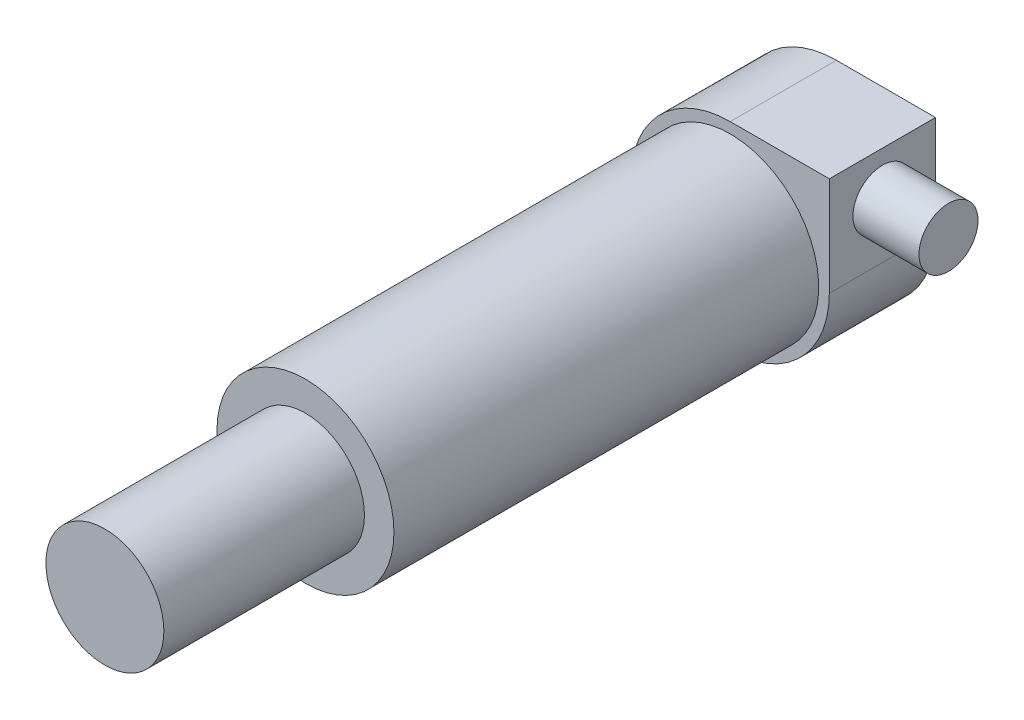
SolidWorks part; units mm, degrees
ref_plane "Plane1" through (0, 0, 0) normal (0, 0, 1) x (1, 0, 0)
ref_plane "Plane2" through (0, 0, 0) normal (0, 1, 0) x (1, 0, 0)
ref_plane "Plane3" through (0, 0, 0) normal (1, 0, 0) x (0, 0, -1)
sketch "Sketch1" plane through (0, 0, 0) normal (0, 0, 1) x (1, 0, 0)
  circle A0 centre (0, 0) radius 19.05
  dimension "D1" = 38.1
extrude "Ti_tube" add sketch "Sketch1" along normal blind 91.44
sketch "Sketch2" plane through (0, 0, 0) normal (0, 0, -1) x (-1, 0, 0)
  line L0 (0, 21.336) -> (-21.336, 21.336)
  line L1 (-21.336, 0) -> (-21.336, 21.336)
  arc A0 (-21.336, 0) -> (0, 21.336) centre (0, 0) ccw
  dimension "D1" = 42.672
  dimension "D2" = 30.1737
extrude "pump_housing" add sketch "Sketch2" along normal blind 22.86
sketch "Sketch3" plane through (21.336, 0, 0) normal (1, 0, 0) x (0, 0, -1)
  line L0 (11.43, 21.336) -> (11.43, 11.811) construction
  line L1 (22.86, 21.336) -> (0, 21.336) construction
  circle A0 centre (11.43, 11.811) radius 6.35
  dimension "D2" = 12.7
  dimension "D1" = 9.525
extrude "hose_barb1" add sketch "Sketch3" along normal blind 14.224
sketch "Sketch4" plane through (0, 0, -22.86) normal (0, 0, -1) x (-1, 0, 0)
  circle A0 centre (0, 0) radius 6.35
  dimension "D1" = 12.7
extrude "hose_barb2" add sketch "Sketch4" along normal blind 14.224
sketch "Sketch5" plane through (0, 0, 91.44) normal (0, 0, 1) x (1, 0, 0)
  circle A0 centre (0, 0) radius 12.7
  dimension "D1" = 25.4
extrude "uw_conn" add sketch "Sketch5" along normal blind 43.18
